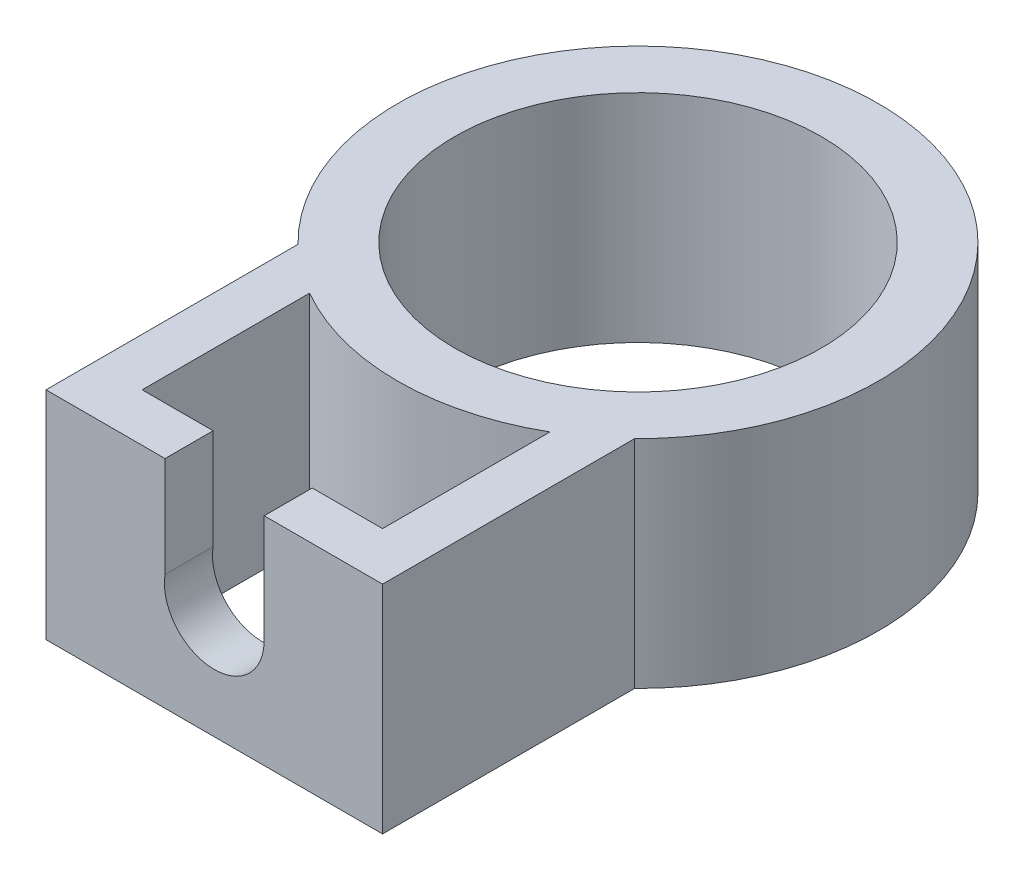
SolidWorks part; units mm, degrees
ref_plane "Alzado" through (0, 0, 0) normal (0, 0, 1) x (1, 0, 0)
ref_plane "Planta" through (0, 0, 0) normal (0, 1, 0) x (1, 0, 0)
ref_plane "Vista lateral" through (0, 0, 0) normal (1, 0, 0) x (0, 0, -1)
sketch "Croquis1" plane through (0, 0, 0) normal (0, 1, 0) x (1, 0, 0)
  line L0 (14, -35.25) -> (14, -14.2829)
  line L1 (-10, -31.25) -> (-6.5, -31.25)
  line L2 (-10, -31.25) -> (-10, -17.3205)
  line L4 (10, -31.25) -> (10, -17.3205)
  line L5 (-10, -31.25) -> (10, -15.25) construction
  line L6 (-10, -15.25) -> (10, -31.25) construction
  line L8 (-14, -35.25) -> (-14, -14.2829)
  line L9 (6.5, -35.25) -> (14, -35.25)
  line L10 (-14, -35.25) -> (-14, -11.25) construction
  line L11 (-14, -11.25) -> (14, -11.25) construction
  line L12 (14, -35.25) -> (14, -11.25) construction
  line L13 (-10, -15.25) -> (10, -15.25) construction
  line L14 (10, -31.25) -> (10, -15.25) construction
  line L15 (-10, -31.25) -> (-10, -15.25) construction
  line L16 (0, 0) -> (0, -4.4481) construction
  line L19 (6.5, -31.25) -> (10, -31.25)
  line L20 (-10, -31.25) -> (10, -31.25) construction
  line L21 (-14, -35.25) -> (14, -35.25) construction
  line L22 (-14, -35.25) -> (-6.5, -35.25)
  line L23 (-6.5, -31.25) -> (6.5, -31.25)
  line L24 (-6.5, -35.25) -> (6.5, -35.25)
  circle A0 centre (0, 0) radius 15.25
  arc A1 (14, -14.2829) -> (-14, -14.2829) centre (0, 0) ccw
  arc A2 (-10, -17.3205) -> (10, -17.3205) centre (0, 0) ccw
  point P4 (0, -23.25)
  dimension "D1" = 30.5
  dimension "D2" = 40
  dimension "D3" = 20
  dimension "D4" = 20.9671
  dimension "D5" = 16
  dimension "D7" = 20.9671
  dimension "D6" = 4
extrude "Saliente-Extruir1" add sketch "Croquis1" along normal blind 18
ref_plane "Plano1" through (0, 0, 35.25) normal (0, 0, 1) x (1, 0, 0)
sketch "Croquis2" plane through (0, 0, 35.25) normal (0, 0, 1) x (1, 0, 0)
  line L0 (14, 18) -> (14, 0) construction
  circle A0 centre (0, 9) radius 4.15
  point P6 (14, 9)
  dimension "D1" = 8.3
extrude "Cortar-Extruir1" cut sketch "Croquis2" against normal blind 10
ref_plane "Plano2" through (0, 0, 35.25) normal (0, 0, 1) x (1, 0, 0)
sketch "Croquis3" plane through (0, 0, 35.25) normal (0, 0, 1) x (1, 0, 0)
  line L1 (-4.0978, 8.8649) -> (4.15, 8.8649)
  line L2 (-4.0978, 8.8649) -> (-4.0978, 18.4115)
  line L3 (-4.0978, 18.4115) -> (4.15, 18.4115)
  line L4 (4.15, 8.8649) -> (4.15, 18.4115)
extrude "Cortar-Extruir2" cut sketch "Croquis3" against normal up to surface (4 mm away)
